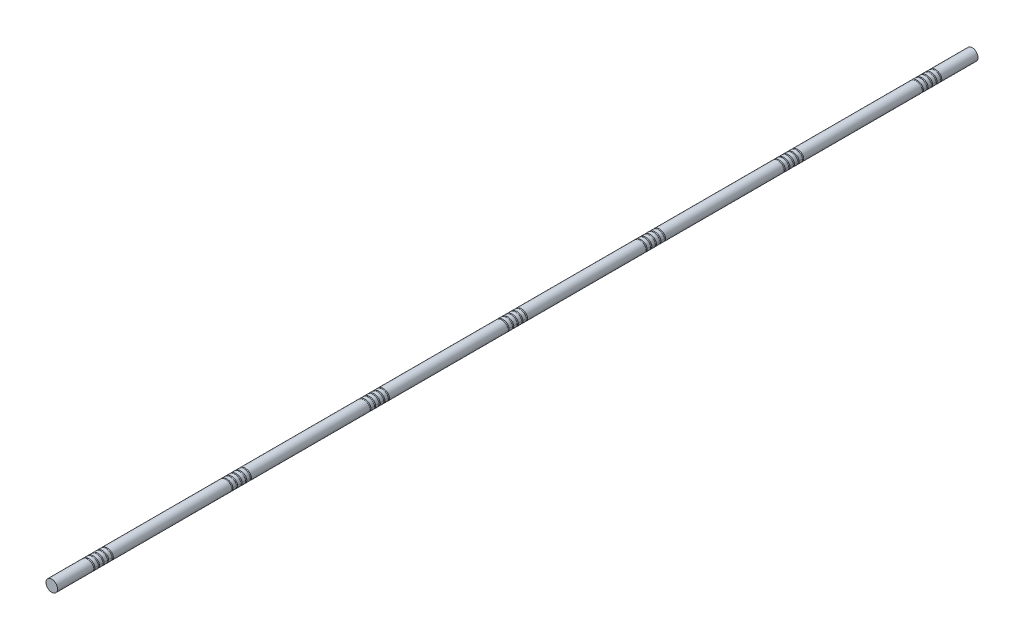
SolidWorks part; units mm, degrees
ref_plane "Front Plane" through (0, 0, 0) normal (0, 0, 1) x (1, 0, 0)
ref_plane "Top Plane" through (0, 0, 0) normal (0, 1, 0) x (1, 0, 0)
ref_plane "Right Plane" through (0, 0, 0) normal (1, 0, 0) x (0, 0, -1)
sketch "Sketch1" plane through (0, 0, 0) normal (0, 0, 1) x (1, 0, 0)
  circle A0 centre (0, 0) radius 25
  dimension "D1" = 50
extrude "Boss-Extrude1" add sketch "Sketch1" along normal blind 4000
ref_plane "Plane1" through (0, 0, 150) normal (0, 0, 1) x (1, 0, 0)
sketch "Sketch2" plane through (0, 0, 150) normal (0, 0, 1) x (1, 0, 0)
  circle A0 centre (0, 0) radius 27.1167
  dimension "D1" = 54.2333
curve "Helix/Spiral1"
sketch "Sketch3" plane through (0, 0, 0) normal (0, 1, 0) x (1, 0, 0)
  circle A0 centre (-27.1167, -150) radius 3.175
  spline S0 degree 3 number of poles 118 (-27.1167, -150) -> (-27.1167, -250) construction
  dimension "D1" = 6.35
sweep "Cut-Sweep1" cut profiles "Sketch3" path "Helix/Spiral1"
pattern_linear "LPattern1" count 7 spacing 600 along (0, 0, -1) of "Cut-Sweep1"
